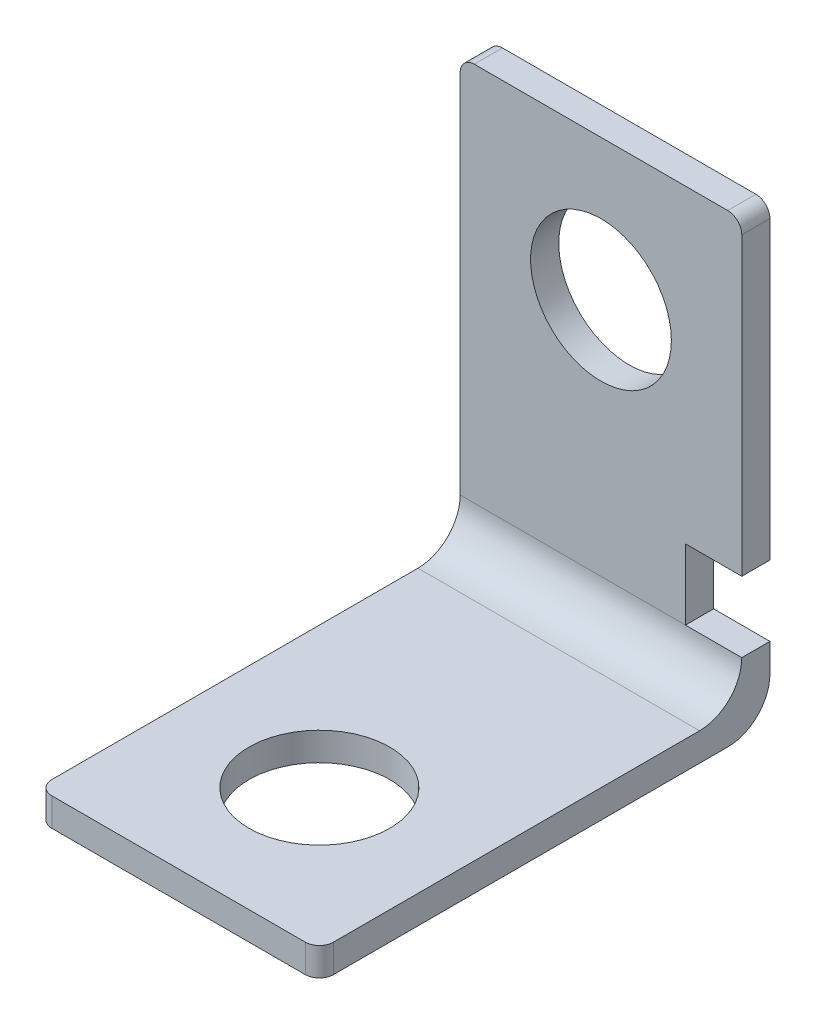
SolidWorks part; units mm, degrees
ref_plane "Front Plane" through (0, 0, 0) normal (0, 0, 1) x (1, 0, 0)
ref_plane "Top Plane" through (0, 0, 0) normal (0, 1, 0) x (1, 0, 0)
ref_plane "Right Plane" through (0, 0, 0) normal (1, 0, 0) x (0, 0, -1)
sketch "Sketch1" plane through (0, 0, 0) normal (1, 0, 0) x (0, 0, -1)
  line L0 (0, 0) -> (30, 0)
  line L1 (30, 0) -> (30, 30)
  dimension "D1" = 30
  dimension "D2" = 30
extrude "Extrude-Thin1" add sketch "Sketch1" along normal blind 20 thin
hole_wizard "Ø10.0 (10) Diameter Hole1" positions "3DSketch1" profile "Sketch2" hole size "Ø10.0" standard "Ansi Metric"
sketch3d "3DSketch1"
  line L0 (20, 0, 0) -> (0, 0, 0) construction
  line L1 (20, 0, 0) -> (20, 0, -30) construction
  point P0 (10, 0, -10)
  dimension "D1" = 10
  dimension "D2" = 10
sketch "Sketch2" plane through (10, 0, -10) normal (1, 0, 0) x (0, 0, 1)
  line L0 (0, 0) -> (0, 5.0043)
  line L1 (0, 5.0043) -> (5, 2)
  line L2 (5, 2) -> (5, 0)
  line L5 (5, 0) -> (0, 0)
  line L10 (0, 5.0043) -> (-5, 2) construction
  line L11 (0, -6.35) -> (0, 107.95) construction
  dimension "Hole Dia." = 10
  dimension "Hole Depth" = 2
  dimension "Drill Angle" = 118
fillet "Fillet1" radius 3 2 edges at (10, -2, -32) (10, 0, -30)
hole_wizard "Ø10.0 (10) Diameter Hole2" positions "3DSketch2" profile "Sketch3" hole size "Ø10.0" standard "Ansi Metric"
sketch3d "3DSketch2"
  line L2 (20, 3, -30) -> (20, 30, -30) construction
  line L3 (20, 30, -30) -> (0, 30, -30) construction
  point P7 (10, 20, -30)
  dimension "D1" = 10
  dimension "D2" = 10
sketch "Sketch3" plane through (10, 20, -30) normal (1, 0, 0) x (0, -1, 0)
  line L0 (0, 0) -> (0, 5.0043)
  line L1 (0, 5.0043) -> (5, 2)
  line L2 (5, 2) -> (5, 0)
  line L5 (5, 0) -> (0, 0)
  line L10 (0, 5.0043) -> (-5, 2) construction
  line L11 (0, -6.35) -> (0, 107.95) construction
  dimension "Hole Dia." = 10
  dimension "Hole Depth" = 2
  dimension "Drill Angle" = 118
sketch "Sketch4" plane through (0, 0, -30) normal (0, 0, 1) x (1, 0, 0)
  line L1 (20, 3) -> (16, 3)
  line L2 (20, 3) -> (20, 8)
  line L3 (20, 8) -> (16, 8)
  line L4 (16, 3) -> (16, 8)
  dimension "D1" = 4
  dimension "D2" = 5
extrude "Cut-Extrude1" cut sketch "Sketch4" against normal up to next
fillet "Fillet2" radius 1 4 edges at (0, -1, 0) (20, -1, 0) (0, 30, -31) (20, 30, -31)
